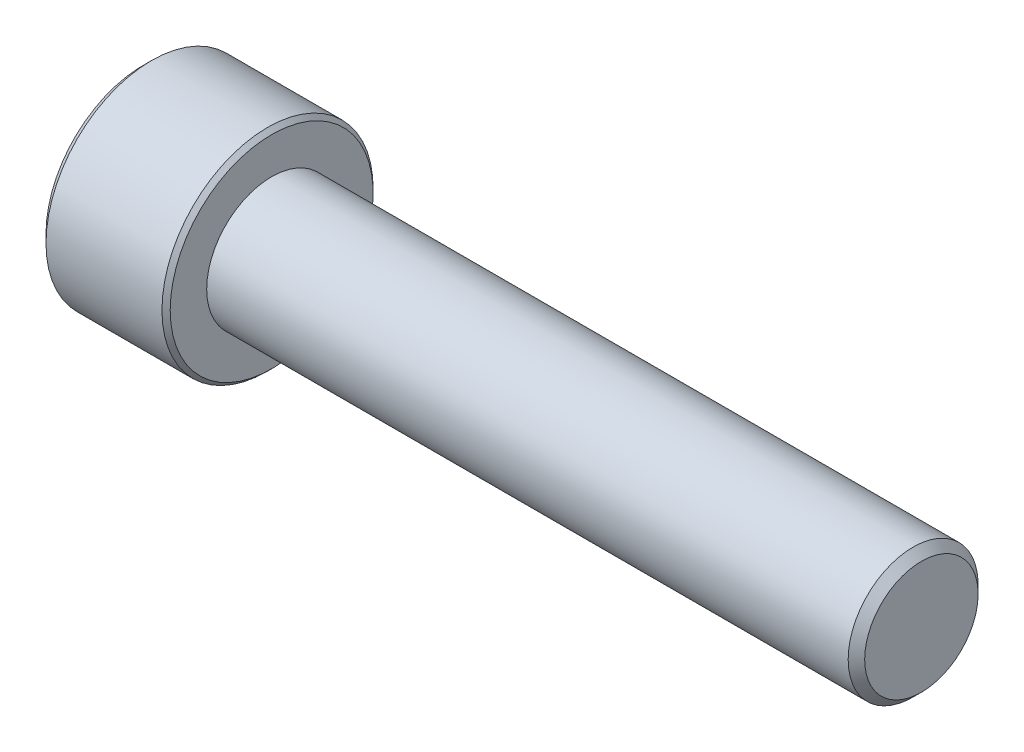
SolidWorks part; units mm, degrees
ref_plane "Front Plane" through (0, 0, 0) normal (0, 0, 1) x (1, 0, 0)
ref_plane "Top Plane" through (0, 0, 0) normal (0, 1, 0) x (1, 0, 0)
ref_plane "Right Plane" through (0, 0, 0) normal (1, 0, 0) x (0, 0, -1)
sketch "Sketch1" plane through (0, 0, 0) normal (0, 0, 1) x (1, 0, 0)
  line L0 (0, 4) -> (0, 6.5)
  line L1 (0, 6.5) -> (-7.9, 6.5)
  line L2 (-7.9, 6.5) -> (-7.9, 0)
  line L3 (-7.9, 0) -> (40, 0)
  line L4 (40, 0) -> (40, 4)
  line L5 (40, 4) -> (0, 4)
  line L6 (-7.9, 0) -> (-21.8708, 0) construction
  dimension "D1" = 7.9
  dimension "D2" = 13
  dimension "D3" = 8
  dimension "D4" = 40
sketch "Sketch2" plane through (0, 0, 0) normal (0, 0, 1) x (1, 0, 0)
  line L0 (-7.9, 0) -> (40, 0) construction
  line L1 (40, 0) -> (40, 4) construction
  line L2 (40, 4) -> (0, 4) construction
  line L3 (0, 4) -> (0, 6.5) construction
  line L4 (0, 6.5) -> (-7.9, 6.5) construction
  line L5 (-7.9, 6.5) -> (-7.9, 0) construction
  line L6 (-7.9, 0) -> (40, 0)
  line L7 (40, 0) -> (40, 4)
  line L8 (40, 4) -> (0, 4)
  line L9 (0, 4) -> (0, 6.5)
  line L10 (0, 6.5) -> (-7.9, 6.5)
  line L11 (-7.9, 6.5) -> (-7.9, 0)
revolve "Revolve1" add sketch "Sketch2" angle 360 about L6
sketch "Sketch3" plane through (-7.9, 0, 0) normal (-1, 0, 0) x (0, 0, 1)
  line L1 (-1.7321, -3) -> (1.7321, -3)
  line L2 (1.7321, -3) -> (3.4641, 0)
  line L3 (3.4641, 0) -> (1.7321, 3)
  line L4 (1.7321, 3) -> (-1.7321, 3)
  line L5 (-1.7321, 3) -> (-3.4641, 0)
  line L6 (-3.4641, 0) -> (-1.7321, -3)
  circle A0 centre (0, 0) radius 3 construction
  dimension "D1" = 6
extrude "Cut-Extrude1" cut sketch "Sketch3" against normal blind 3.556
chamfer "Chamfer1" distance 0.508 angle 45 2 edges at (40, 0, 4) (-7.9, 0, 6.5)
chamfer "Chamfer2" distance 0.254 angle 45 1 edges at (0, 0, 6.5)
